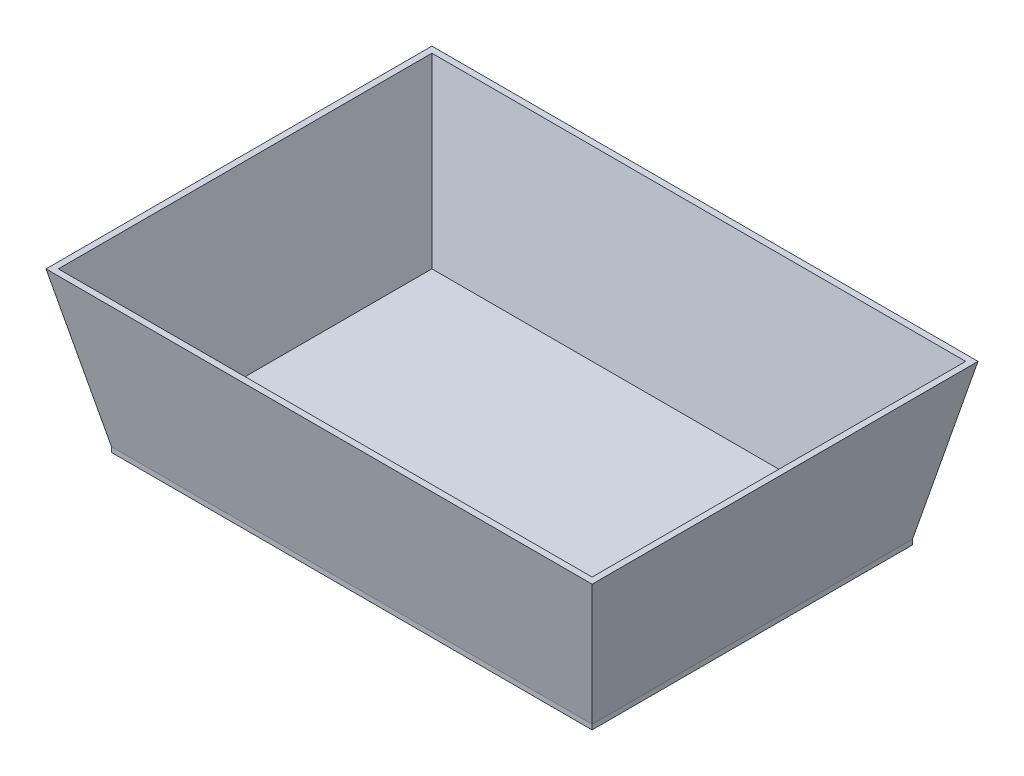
SolidWorks part; units mm, degrees
ref_plane "Front Plane" through (0, 0, 0) normal (0, 0, 1) x (1, 0, 0)
ref_plane "Top Plane" through (0, 0, 0) normal (0, 1, 0) x (1, 0, 0)
ref_plane "Right Plane" through (0, 0, 0) normal (1, 0, 0) x (0, 0, -1)
sketch "Sketch2" plane through (0, 0, 0) normal (0, 1, 0) x (1, 0, 0)
  line L1 (-123.825, -82.55) -> (123.825, -82.55)
  line L2 (-123.825, -82.55) -> (-123.825, 82.55)
  line L3 (-123.825, 82.55) -> (123.825, 82.55)
  line L4 (123.825, -82.55) -> (123.825, 82.55)
  line L5 (-123.825, -82.55) -> (123.825, 82.55) construction
  line L6 (-123.825, 82.55) -> (123.825, -82.55) construction
  point P0 (0, 0)
  dimension "D1" = 247.65
  dimension "D2" = 165.1
extrude "Boss-Extrude2" add sketch "Sketch2" along normal blind 79.375 draft 12
sketch "Sketch3" plane through (0, 79.375, 0) normal (0, 1, 0) x (1, 0, 0)
  line L0 (140.6967, 99.4217) -> (-140.6967, 99.4217) construction
  line L1 (-137.5217, -96.2467) -> (137.5217, -96.2467)
  line L2 (-137.5217, -96.2467) -> (-137.5217, 96.2467)
  line L3 (-137.5217, 96.2467) -> (137.5217, 96.2467)
  line L4 (137.5217, -96.2467) -> (137.5217, 96.2467)
  line L5 (-137.5217, -96.2467) -> (137.5217, 96.2467) construction
  line L6 (-137.5217, 96.2467) -> (137.5217, -96.2467) construction
  line L7 (-140.6967, 99.4217) -> (-140.6967, -99.4217) construction
  point P0 (0, 0)
  dimension "D1" = 3.175
  dimension "D2" = 3.175
extrude "Cut-Extrude1" cut sketch "Sketch3" against normal blind 139.7 draft 12
sketch "Sketch4" plane through (0, 0, 0) normal (0, -1, 0) x (1, 0, 0)
  line L1 (123.825, -82.55) -> (-123.825, -82.55)
  line L2 (123.825, -82.55) -> (123.825, 82.55)
  line L3 (123.825, 82.55) -> (-123.825, 82.55)
  line L4 (-123.825, -82.55) -> (-123.825, 82.55)
  line L5 (123.825, -82.55) -> (-123.825, 82.55) construction
  line L6 (123.825, 82.55) -> (-123.825, -82.55) construction
  point P1 (0, 0)
extrude "Boss-Extrude3" add sketch "Sketch4" along normal blind 2.54
